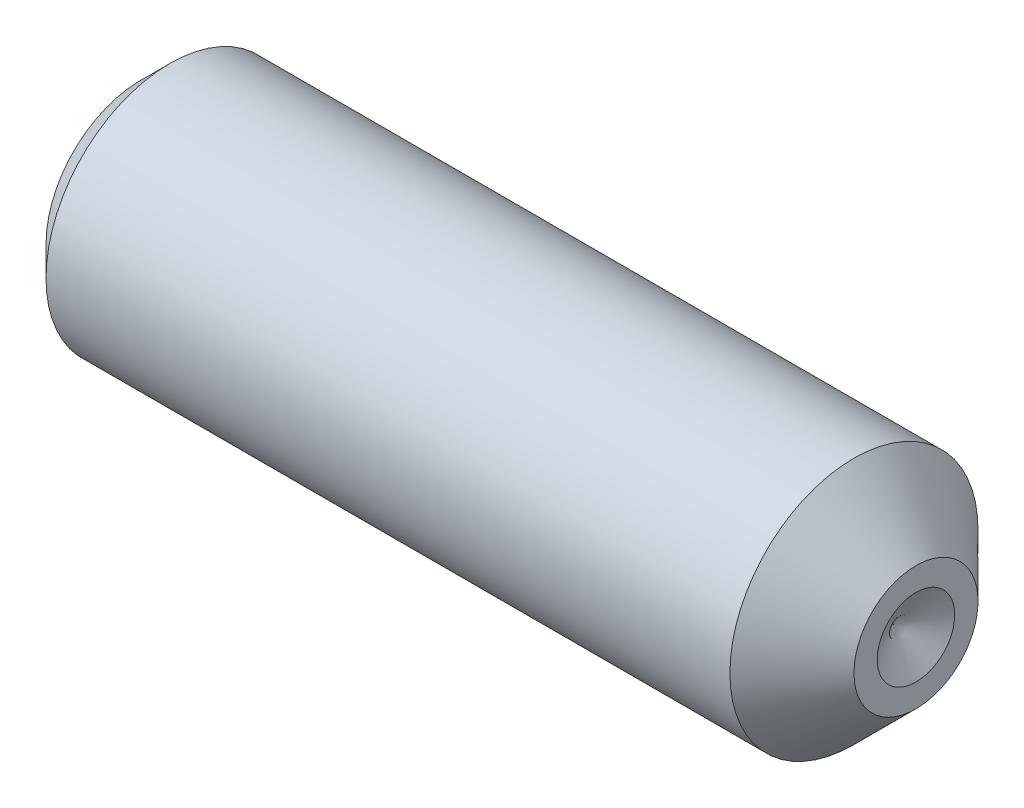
SolidWorks part; units mm, degrees
ref_plane "Front" through (0, 0, 0) normal (0, 0, 1) x (1, 0, 0)
ref_plane "Top" through (0, 0, 0) normal (0, 1, 0) x (1, 0, 0)
ref_plane "Right" through (0, 0, 0) normal (1, 0, 0) x (0, 0, -1)
sketch "Sketch1" plane through (0, 0, 0) normal (0, 0, 1) x (1, 0, 0)
  line L0 (0, 0) -> (5, 0)
  line L1 (5, 0) -> (5, 0.4)
  line L2 (5, 0.4) -> (4.6, 0.8)
  line L3 (4.6, 0.8) -> (0.1895, 0.8)
  line L4 (0.1895, 0.8) -> (0, 0.6105)
  line L5 (0, 0.6105) -> (0, 0)
  line L6 (-10.745, 0) -> (0.8952, 0) construction
  dimension "D1" = 45
  dimension "l" = 5
  dimension "D2" = 45
  dimension "dz" = 0.8
  dimension "d" = 1.6
  dimension "df" = 1.221
revolve "Base" add sketch "Sketch1" angle 360 about L6
sketch "Sketch2" plane through (0, 0.1805, -0.2958) normal (-1, 0, 0) x (0, 0, 1)
  line L1 (0.6999, -0.1805) -> (0.4979, 0.1695)
  line L2 (0.4979, 0.1695) -> (0.0937, 0.1695)
  line L3 (0.0937, 0.1695) -> (-0.1084, -0.1805)
  line L4 (-0.1084, -0.1805) -> (0.0937, -0.5305)
  line L5 (0.0937, -0.5305) -> (0.4979, -0.5305)
  line L6 (0.4979, -0.5305) -> (0.6999, -0.1805)
  circle A0 centre (0.2958, -0.1805) radius 0.35 construction
  dimension "s" = 0.7
extrude "HexagonSocket" cut sketch "Sketch2" against normal blind 0.7
sketch "Sketch3" plane through (5, -0.0018, -0.0116) normal (1, 0, 0) x (0, 0, -1)
  circle A0 centre (-0.0116, 0.0018) radius 0.25
  circle A1 centre (-0.0116, 0.0018) radius 0.4 construction
  dimension "D1" = 0.5
extrude "Cut-Extrude1" cut sketch "Sketch3" against normal blind 10 draft 60
sketch "Sketch4" plane through (0, 0, 0) normal (0, 0, 1) x (1, 0, 0)
  line L0 (0.2372, 0) -> (-5.2372, 0) construction
  line L2 (0.7, 0.35) -> (0.9021, 0)
  line L3 (0.9021, 0) -> (0.7, 0)
  line L4 (0.7, 0) -> (0.7, 0.35)
  dimension "D1" = 60
revolve "Cut-Revolve1" cut sketch "Sketch4" angle 360 about L0
sketch "Sketch5" plane through (0, 0, 0) normal (0, 0, 1) x (1, 0, 0)
  line L0 (0.1895, 0.7134) -> (0.2395, 0.8)
  line L1 (0.2395, 0.8) -> (0.2395, 0.9)
  line L2 (0.2395, 0.9) -> (0.1395, 0.9)
  line L3 (0.1395, 0.9) -> (0.1395, 0.8)
  line L4 (0.1395, 0.8) -> (0.1895, 0.7134)
  line L5 (0.1895, 0.8) -> (0.1895, -0.8) construction
  line L6 (0, 0) -> (2.2912, 0) construction
  line L7 (0, 0.6105) -> (0, -0.6105) construction
  dimension "D1" = 1.6
  dimension "D2" = 0.1
revolve "Cut-Revolve10" [suppressed] cut sketch "Sketch5" angle 360 about L6
pattern_linear "LPattern10" [suppressed] count 40 spacing 0.12 along (1, 0, 0)
equation "\"D1@Sketch3\" = \"dz@Sketch1\" - 0.3"
equation "\"D1@Sketch5\" = \"d@Sketch1\""
equation "\"D2@Sketch5\" =  ( \"d@Sketch1\" - \"D2@ThreadCosmetic1\" )  / 2"
equation "\"D3@LPattern10\" = \"D2@Sketch5\" * 1.2"
equation "\"D1@LPattern10\" = (  \"l@Sketch1\" -  ( \"d@Sketch1\" - \"df@Sketch1\" )  / 2 )  / \"D3@LPattern10\""
